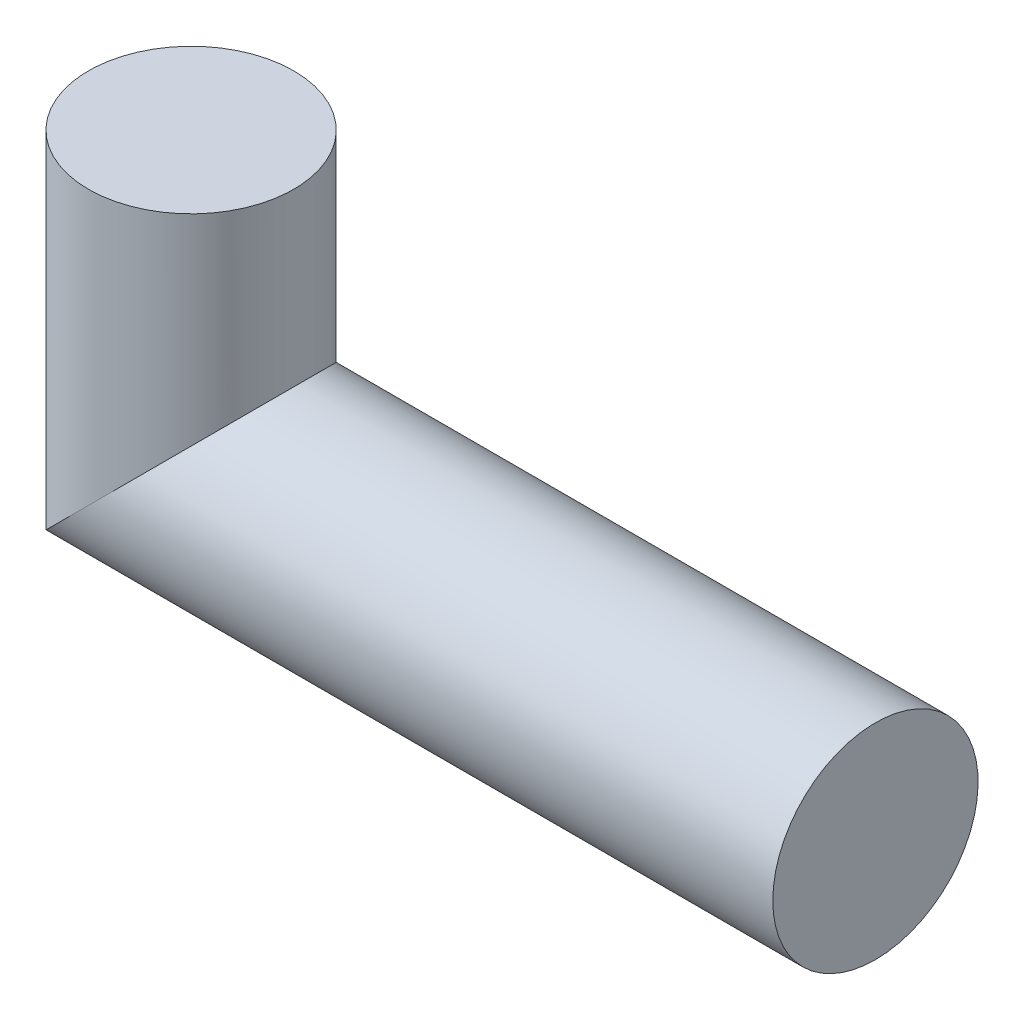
SolidWorks part; units mm, degrees
ref_plane "Front Plane" through (0, 0, 0) normal (0, 0, 1) x (1, 0, 0)
ref_plane "Top Plane" through (0, 0, 0) normal (0, 1, 0) x (1, 0, 0)
ref_plane "Right Plane" through (0, 0, 0) normal (1, 0, 0) x (0, 0, -1)
sketch "Sketch1" plane through (0, 0, 0) normal (0, 1, 0) x (1, 0, 0)
  circle A0 centre (0, 0) radius 19.05
  dimension "D1" = 38.1
sketch "Sketch2" plane through (0, 0, 0) normal (0, 0, 1) x (1, 0, 0)
  line L0 (0, 0) -> (0, -50.8)
  line L1 (0, -50.8) -> (127, -50.8)
  dimension "D1" = 50.8
  dimension "D2" = 127
sweep "Sweep1" add profiles "Sketch1" path "Sketch2"
